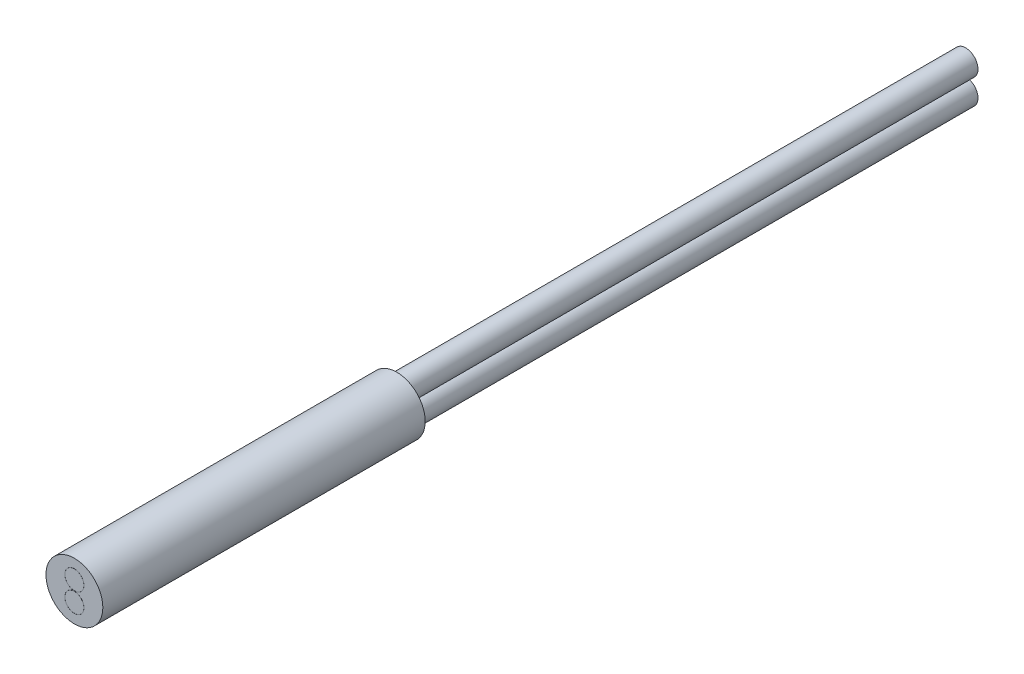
SolidWorks part; units mm, degrees
ref_plane "前视基准面" through (0, 0, 0) normal (0, 0, 1) x (1, 0, 0)
ref_plane "上视基准面" through (0, 0, 0) normal (0, 1, 0) x (1, 0, 0)
ref_plane "右视基准面" through (0, 0, 0) normal (1, 0, 0) x (0, 0, -1)
sketch "草图1" plane through (0, 0, 0) normal (0, 0, 1) x (1, 0, 0)
  circle A0 centre (0, 0) radius 1.5
  dimension "D1" = 3
extrude "凸台-拉伸1" add sketch "草图1" against normal blind 17
sketch "草图2" plane through (0, 0, -17) normal (0, 0, -1) x (-1, 0, 0)
  circle A0 centre (0, 0.66) radius 0.65
  circle A1 centre (0, -0.66) radius 0.65
  point P4 (0, 0)
  point P5 (0, -0.7699)
  dimension "D1" = 1.3
  dimension "D2" = 0.01
  dimension "D3" = 0.01
extrude "凸台-拉伸2" add sketch "草图2" along normal blind 30
sketch "草图3" plane through (0, 0, 0) normal (0, 0, 1) x (1, 0, 0)
  circle A0 centre (0, 0.515) radius 0.505
  circle A1 centre (0, -0.515) radius 0.505
  circle A2 centre (0, 0.515) radius 0.5
  circle A3 centre (0, -0.515) radius 0.5
  dimension "D1" = 1.01
  dimension "D2" = 1
  dimension "D3" = 0.01
  dimension "D4" = 0.01
extrude "切除-拉伸1" cut sketch "草图3" against normal blind 0.1
